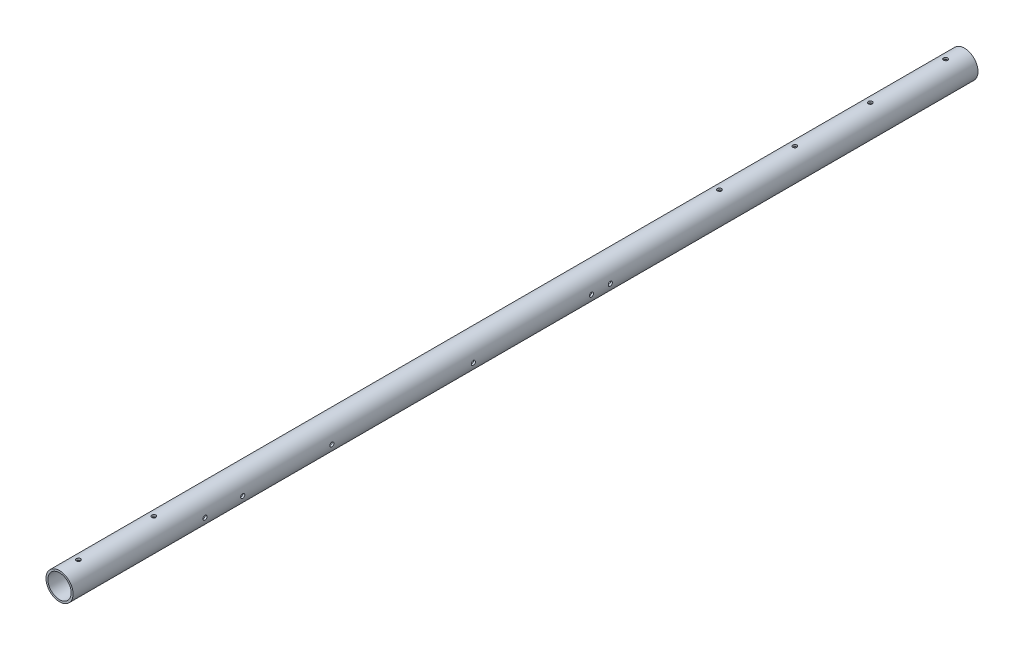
SolidWorks part; units mm, degrees
ref_plane "Front Plane" through (0, 0, 0) normal (0, 0, 1) x (1, 0, 0)
ref_plane "Top Plane" through (0, 0, 0) normal (0, 1, 0) x (1, 0, 0)
ref_plane "Right Plane" through (0, 0, 0) normal (1, 0, 0) x (0, 0, -1)
sketch "Sketch1" plane through (0, 0, 0) normal (0, 0, 1) x (1, 0, 0)
  circle A0 centre (0, 0) radius 36.5125
  circle A1 centre (0, 0) radius 31.369
  dimension "D1" = 73.025
  dimension "D2" = 62.738
extrude "Extrude1" add sketch "Sketch1" along normal mid plane 2438.4
ref_plane "Plane1" through (0, 36.576, 0) normal (0, 1, 0) x (-1, 0, 0)
sketch "Sketch3" plane through (0, 36.576, 0) normal (0, 1, 0) x (-1, 0, 0)
  line L0 (-36.5125, -1219.2) -> (36.5125, -1219.2) construction
  circle A0 centre (0, -1168.4) radius 5.588
  dimension "D1" = 11.176
  dimension "D2" = 50.8
extrude "Cut-Extrude2" cut sketch "Sketch3" against normal through all
pattern_linear "LPattern2" count 4 spacing 203.2 along (0, 0, 1) of "Cut-Extrude2"
sketch "Sketch4" plane through (0, 36.576, 0) normal (0, 1, 0) x (-1, 0, 0)
  line L0 (0, 1219.2) -> (0, -1219.2) construction
  line L1 (36.5125, 1219.2) -> (-36.5125, 1219.2) construction
  circle A0 centre (0, 1168.4) radius 5.588
  dimension "D1" = 11.176
  dimension "D2" = 50.8
extrude "Cut-Extrude3" cut sketch "Sketch4" against normal through all
pattern_linear "LPattern3" count 2 spacing 203.2 along (0, 0, -1) of "Cut-Extrude3"
ref_plane "Plane2" through (36.576, 0, 0) normal (1, 0, 0) x (0, 0, -1)
sketch "Sketch5" plane through (36.576, 0, 0) normal (1, 0, 0) x (0, 0, -1)
  line L0 (-1219.2, 36.5125) -> (-1219.2, -36.5125) construction
  circle A0 centre (-863.6, 0) radius 5.588
  dimension "D1" = 11.176
  dimension "D2" = 355.6
extrude "Cut-Extrude4" cut sketch "Sketch5" against normal through all
pattern_linear "LPattern4" count 2 spacing 101.6 along (0, 0, -1) of "Cut-Extrude4"
sketch "Sketch6" plane through (36.576, 0, 0) normal (1, 0, 0) x (0, 0, -1)
  line L0 (-1219.2, 0) -> (1219.2, 0) construction
  line L1 (-1219.2, 36.5125) -> (-1219.2, -36.5125) construction
  circle A0 centre (177.8, 0) radius 5.588
  dimension "D1" = 11.176
  dimension "D2" = 1397
extrude "Cut-Extrude5" cut sketch "Sketch6" against normal through all
pattern_linear "LPattern5" count 2 spacing 50.8 along (0, 0, -1) of "Cut-Extrude5"
sketch "Sketch7" plane through (36.576, 0, 0) normal (1, 0, 0) x (0, 0, -1)
  line L0 (-1219.2, 36.5125) -> (-1219.2, -36.5125) construction
  circle A0 centre (-521.462, 0) radius 5.588
  circle A1 centre (-140.462, 0) radius 5.588
  dimension "D1" = 11.176
  dimension "D2" = 697.738
  dimension "D3" = 381
extrude "Cut-Extrude6" cut sketch "Sketch7" against normal through all
